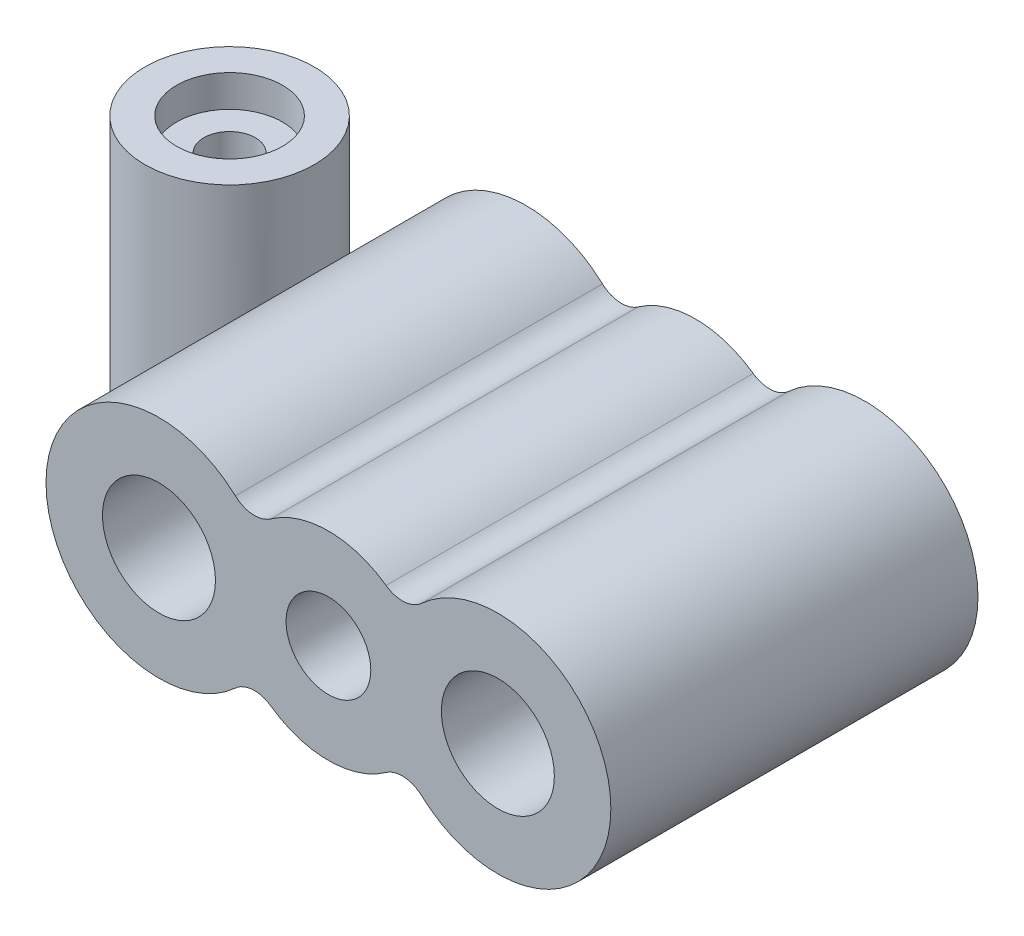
SolidWorks part; units mm, degrees
ref_plane "Front Plane" through (0, 0, 0) normal (0, 0, 1) x (1, 0, 0)
ref_plane "Top Plane" through (0, 0, 0) normal (0, 1, 0) x (1, 0, 0)
ref_plane "Right Plane" through (0, 0, 0) normal (1, 0, 0) x (0, 0, -1)
sketch "Sketch1" plane through (0, 0, 0) normal (0, 0, 1) x (1, 0, 0)
  arc A0 (-6.4761, -9.1084) -> (6.4761, -9.1084) centre (0, 0) ccw
  arc A1 (10.4628, -9.3568) -> (10.4628, 9.3568) centre (19.05, 0) ccw
  arc A2 (-10.4628, 9.3568) -> (-10.4628, -9.3568) centre (-19.05, 0) ccw
  arc A3 (6.4761, 9.1084) -> (-6.4761, 9.1084) centre (0, 0) ccw
  arc A4 (-10.4628, 9.3568) -> (-6.4761, 9.1084) centre (-8.316, 11.696) ccw
  arc A5 (10.4628, 9.3568) -> (6.4761, 9.1084) centre (8.316, 11.696) cw
  arc A6 (-10.4628, -9.3568) -> (-6.4761, -9.1084) centre (-8.316, -11.696) cw
  arc A7 (10.4628, -9.3568) -> (6.4761, -9.1084) centre (8.316, -11.696) ccw
  point P12 (8.57, 7.1735)
  dimension "OD" = 25.4
  dimension "D4" = 22.352
  dimension "D5" = 3.175
  dimension "D1" = 38.1
  dimension "D2" = 19.05
extrude "Extrude1" add sketch "Sketch1" along normal mid plane 41.275
sketch "Sketch3" plane through (0, 0, 0) normal (0, 1, 0) x (1, 0, 0)
  line L1 (-10.4628, 20.6375) -> (-31.75, 20.6375) construction
  circle A0 centre (-38.1, 6.35) radius 9.525
  dimension "D2" = 19.05
  dimension "D1" = 38.1
  dimension "D3" = 14.2875
extrude "Extrude3" add sketch "Sketch3" along normal mid plane 38.1
sketch "Sketch4" plane through (0, 0, 20.6375) normal (0, 0, 1) x (1, 0, 0)
  circle A0 centre (-19.05, 0) radius 6.35
  dimension "ID" = 12.7
extrude "Cut-Extrude1" cut sketch "Sketch4" against normal through all
sketch "Sketch5" plane through (19.9268, 0.3998, 20.6375) normal (0, 0, 1) x (1, 0, 0)
  circle A0 centre (-19.9268, -0.3998) radius 4.7625
  dimension "D1" = 9.525
extrude "Cut-Extrude2" cut sketch "Sketch5" against normal through all
sketch "Sketch6" plane through (38.7891, -0.1741, 20.6375) normal (0, 0, 1) x (1, 0, 0)
  circle A0 centre (-19.7391, 0.1741) radius 6.35
extrude "Cut-Extrude3" cut sketch "Sketch6" against normal through all
hole_wizard "CBORE for #12 Binding Head Machine Screw1" positions "Sketch8" profile "Sketch7" counterbore size "#12" standard "Ansi Inch"
sketch "Sketch8" plane through (0, 19.05, 0) normal (0, 1, 0) x (-1, 0, 0)
  point P0 (38.1, -6.35)
sketch "Sketch7" plane through (-38.1, 19.05, -6.35) normal (1, 0, 0) x (0, 0, 1)
  line L0 (0, 0) -> (0, 38.1)
  line L1 (0, 38.1) -> (2.8956, 38.1)
  line L3 (2.8956, 38.1) -> (2.8956, 3.5814)
  line L4 (2.8956, 3.5814) -> (5.9538, 3.5814)
  line L5 (5.9538, 3.5814) -> (5.9538, 0)
  line L7 (5.9538, 0) -> (0, 0)
  line L11 (0, -6.35) -> (0, 107.95) construction
  dimension "Thru Hole Dia." = 5.7912
  dimension "Thru Hole Depth" = 38.1
  dimension "C'Bore Dia." = 11.9075
  dimension "C'Bore Depth" = 3.5814
fillet "Fillet3" radius 1.5875
fillet "Fillet4" radius 1.5875
